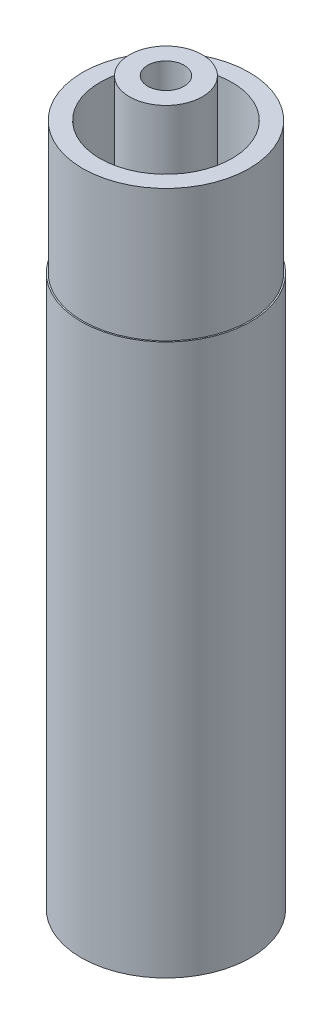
SolidWorks part; units mm, degrees
ref_plane "Front Plane" through (0, 0, 0) normal (0, 0, 1) x (1, 0, 0)
ref_plane "Top Plane" through (0, 0, 0) normal (0, 1, 0) x (1, 0, 0)
ref_plane "Right Plane" through (0, 0, 0) normal (1, 0, 0) x (0, 0, -1)
sketch "Sketch1" plane through (0, 0, 0) normal (0, 0, 1) x (1, 0, 0)
  line L0 (0, 0) -> (0, -74.4589) construction
  line L1 (-2.2733, 0) -> (-4.7244, 0)
  line L2 (-4.7244, 0) -> (-4.7244, 30.734)
  line L3 (-4.7244, 30.734) -> (-4.6482, 30.734)
  line L4 (-4.6482, 30.734) -> (-4.6482, 38.1)
  line L5 (-4.6482, 38.1) -> (-3.683, 38.1)
  line L6 (-3.683, 38.1) -> (-3.683, 30.734)
  line L7 (-3.683, 30.734) -> (-2.032, 30.734)
  line L8 (-2.032, 30.734) -> (-2.032, 40.259)
  line L9 (-2.032, 40.259) -> (-1.016, 40.259)
  line L11 (-2.2733, 0) -> (-2.2733, 28.1031)
  line L12 (-2.2733, 28.1031) -> (-1.016, 28.829)
  line L13 (-1.016, 28.829) -> (-1.016, 40.259)
  dimension "D1" = 9.4488
  dimension "D2" = 9.2964
  dimension "D3" = 7.366
  dimension "D4" = 9.525
  dimension "D5" = 4.064
  dimension "D6" = 7.366
  dimension "D7" = 38.1
  dimension "D8" = 4.5466
  dimension "D9" = 2.159
  dimension "D10" = 1.016
  dimension "D11" = 120
  dimension "D12" = 11.43
revolve "Revolve1" add sketch "Sketch1" angle 360 about L0
sketch "Sketch2" plane through (0, 0, 0) normal (0, 0, 1) x (1, 0, 0)
  line L0 (0, 11.6623) -> (-4.1275, 10.16)
  line L1 (-4.1275, 10.16) -> (-4.1275, 6.35)
  line L2 (-4.1275, 6.35) -> (0, 6.35)
  line L3 (0, 6.35) -> (0, 11.6623)
  line L4 (0, 0) -> (0, 11.6623) construction
  dimension "D1" = 8.255
  dimension "D2" = 70
  dimension "D3" = 3.81
  dimension "D4" = 6.35
revolve "Revolve2" add sketch "Sketch2" angle 360 about L4
